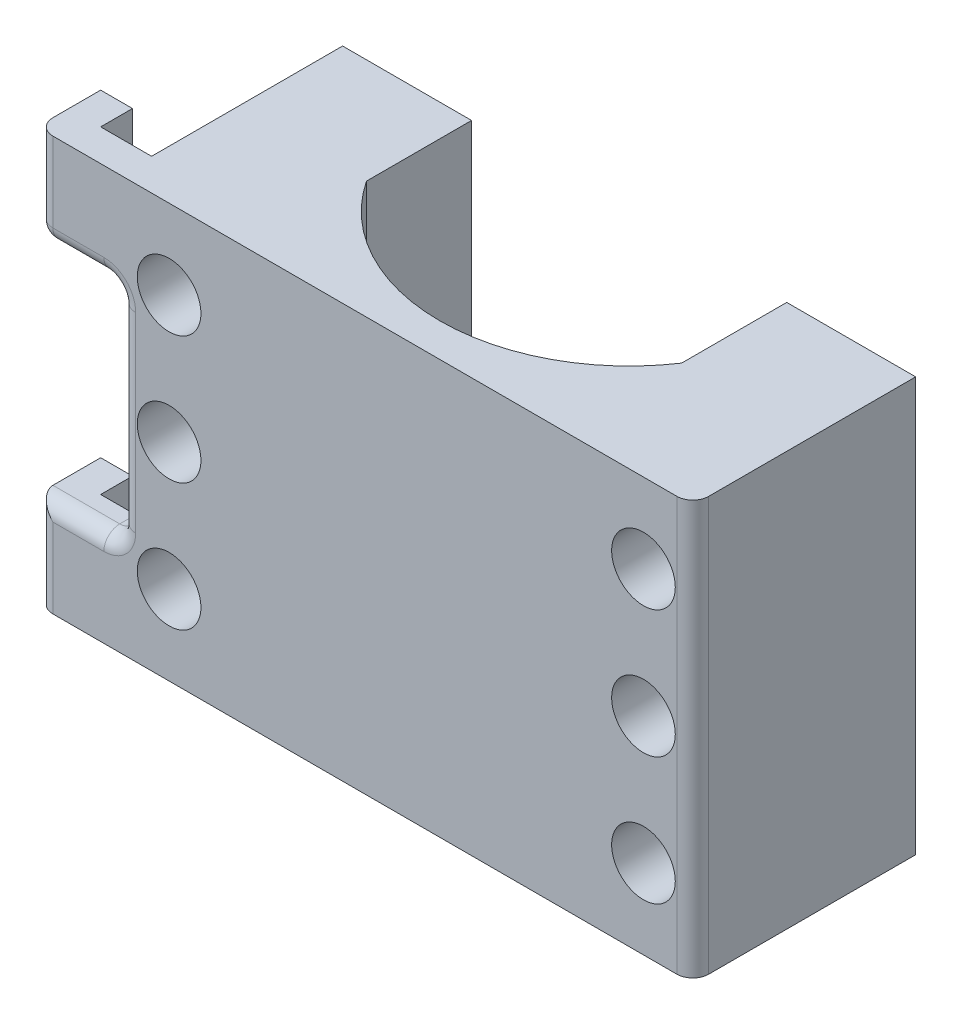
SolidWorks part; units mm, degrees
ref_plane "前视基准面" through (0, 0, 0) normal (0, 0, 1) x (1, 0, 0)
ref_plane "上视基准面" through (0, 0, 0) normal (0, 1, 0) x (1, 0, 0)
ref_plane "右视基准面" through (0, 0, 0) normal (1, 0, 0) x (0, 0, -1)
sketch "草图1" plane through (0, 0, 0) normal (0, 0, 1) x (1, 0, 0)
  line L1 (-9, -6.5) -> (9, -6.5)
  line L2 (-9, -6.5) -> (-9, 6.5)
  line L3 (-9, 6.5) -> (9, 6.5)
  line L4 (9, -6.5) -> (9, 6.5)
  line L5 (-9, -6.5) -> (9, 6.5) construction
  line L6 (-9, 6.5) -> (9, -6.5) construction
  line L7 (-5.95, -6.5) -> (5.95, -6.5)
  line L8 (-5.95, -6.5) -> (-5.95, 6.5)
  line L9 (-5.95, 6.5) -> (5.95, 6.5)
  line L10 (5.95, -6.5) -> (5.95, 6.5)
  line L11 (-5.95, -6.5) -> (5.95, 6.5) construction
  line L12 (-5.95, 6.5) -> (5.95, -6.5) construction
  circle A0 centre (-7.45, 4) radius 1
  point P0 (0, 0)
  point P6 (0, 0)
  dimension "D3" = 2
  dimension "D5" = 2.5
  dimension "D1" = 11.9
  dimension "D2" = 18
  dimension "D4" = 1.5
  dimension "D6" = 13
extrude "凸台-拉伸1" add sketch "草图1" along normal blind 14 contours L1 L8 L3 L2 A0 | L1 L10 L3 L8 | L10 L1 L4 L3 | A0
sketch "草图2" plane through (0, 0, 14) normal (0, 0, 1) x (1, 0, 0)
  line L0 (55, 0) -> (-55, 0) construction
  line L1 (0, -55) -> (0, 55) construction
  line L2 (-7.45, 0) -> (0, 0) construction
  circle A0 centre (-7.45, 4) radius 1 construction
  circle A1 centre (-7.45, 4) radius 1
  circle A2 centre (-7.45, -4) radius 1
  circle A3 centre (7.45, -4) radius 1
  circle A4 centre (7.45, 4) radius 1
  circle A5 centre (-7.45, 0) radius 1
  circle A6 centre (7.45, 0) radius 1
extrude "切除-拉伸1" cut sketch "草图2" against normal through all
sketch "草图4" plane through (0, 6.5, 0) normal (0, 1, 0) x (1, 0, 0)
  line L0 (-9, -7) -> (0, -7) construction
  line L1 (-9, -14) -> (-9, 0) construction
  line L2 (0, -7) -> (0, 0) construction
  line L4 (4.95, -11.95) -> (-4.95, -11.95)
  line L5 (4.95, -11.95) -> (4.95, -2.05)
  line L6 (4.95, -2.05) -> (-4.95, -2.05)
  line L7 (-4.95, -11.95) -> (-4.95, -2.05)
  line L8 (4.95, -11.95) -> (-4.95, -2.05) construction
  line L9 (4.95, -2.05) -> (-4.95, -11.95) construction
  circle A0 centre (0, -7) radius 5.95
  dimension "D1" = 11.9
  dimension "D2" = 9.9
extrude "切除-拉伸2" cut sketch "草图4" against normal through all contours L4 A0 L5 L6 L7 | L6 A0 | L4 A0
sketch "草图5" plane through (0, 0, 0) normal (0, 0, -1) x (-1, 0, 0)
  line L1 (-9, -6.5) -> (9, -6.5)
  line L2 (-9, -6.5) -> (-9, 6.5)
  line L3 (-9, 6.5) -> (9, 6.5)
  line L4 (9, -6.5) -> (9, 6.5)
  line L5 (-9, -6.5) -> (9, 6.5) construction
  line L6 (-9, 6.5) -> (9, -6.5) construction
  point P0 (0, 0)
extrude "切除-拉伸3" cut sketch "草图5" against normal blind 7
sketch "草图6" plane through (-9, 0, 0) normal (-1, 0, 0) x (0, 0, 1)
  line L0 (14, -6.5) -> (7, -6.5) construction
  line L1 (14, 6.5) -> (13, 6.5)
  line L2 (14, 6.5) -> (14, -6.5)
  line L3 (14, -6.5) -> (13, -6.5)
  line L4 (13, 6.5) -> (13, -6.5)
  dimension "D1" = 1
extrude "凸台-拉伸2" add sketch "草图6" along normal blind 1.6
sketch "草图7" plane through (-10.6, 0, 0) normal (-1, 0, 0) x (0, 0, 1)
  line L0 (13, -6.5) -> (7, -6.5) construction
  line L1 (14, 6.5) -> (12, 6.5)
  line L2 (14, 6.5) -> (14, -6.5)
  line L3 (14, -6.5) -> (12, -6.5)
  line L4 (12, 6.5) -> (12, -6.5)
  dimension "D1" = 2
extrude "凸台-拉伸3" add sketch "草图7" along normal blind 1
sketch "草图8" plane through (-11.6, 0, 0) normal (-1, 0, 0) x (0, 0, 1)
  line L0 (12, 6.5) -> (12, -6.5) construction
  line L1 (10, -3.5) -> (14, -3.5)
  line L2 (10, -3.5) -> (10, 3.5)
  line L3 (10, 3.5) -> (14, 3.5)
  line L4 (14, -3.5) -> (14, 3.5)
  line L5 (10, -3.5) -> (14, 3.5) construction
  line L6 (10, 3.5) -> (14, -3.5) construction
  line L7 (14, -6.5) -> (14, 6.5) construction
  point P0 (12, 0)
  dimension "D1" = 7
extrude "切除-拉伸6" cut sketch "草图8" against normal up to surface (2.6 mm away)
fillet "圆角1" radius 0.5 9 edges at (-11.6, 3.5, 13) (-9, 3.5, 13.5) (-11.6, -5, 14) (-9, -3.5, 13.5) (-11.6, 5, 14) (-10.3, 3.5, 14) (-10.3, -3.5, 14) (-9, 0, 14) (9, 0, 14)
